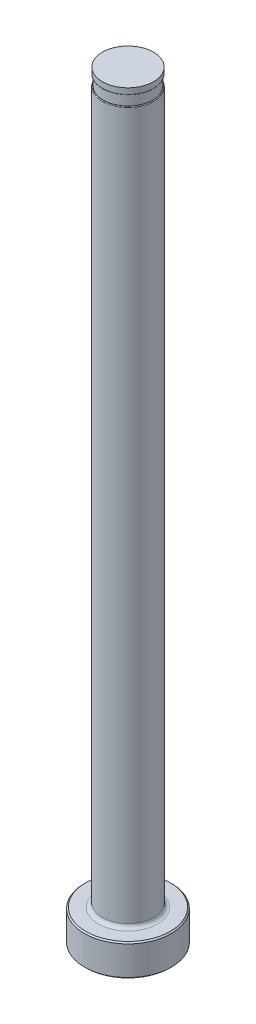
SolidWorks part; units mm, degrees
ref_plane "Front Plane" through (0, 0, 0) normal (0, 0, 1) x (1, 0, 0)
ref_plane "Top Plane" through (0, 0, 0) normal (0, 1, 0) x (1, 0, 0)
ref_plane "Right Plane" through (0, 0, 0) normal (1, 0, 0) x (0, 0, -1)
other "Configuration Table"
sketch "Sketch1" plane through (0, 0, 0) normal (0, 0, 1) x (1, 0, 0)
  line L0 (0, 259.9588) -> (0, -15.1925) construction
  line L1 (0, 0) -> (-8.7249, 0)
  line L2 (-8.7249, 0) -> (-8.7249, 6.35)
  line L3 (-8.7249, 6.35) -> (-5.1587, 6.35)
  line L4 (-5.1587, 6.35) -> (-5.1587, 152.4)
  line L5 (-5.1587, 152.4) -> (0, 152.4)
  line L6 (0, 152.4) -> (0, 0)
  dimension "L" = 152.4
  dimension "H" = 17.4498
  dimension "T" = 6.35
  dimension "D" = 10.3175
revolve "Revolve1" add sketch "Sketch1" angle 360 about L0
chamfer "Chamfer1" distance 0.254 angle 45 2 edges at (0, 6.35, 8.7249) (0, 0, 8.7249)
fillet "Fillet1" radius 0.762 1 edges at (0, 6.35, 5.1587)
sketch "Sketch2" plane through (0, 0, 0) normal (0, 0, 1) x (1, 0, 0)
  line L0 (-5.1587, 152.4) -> (-5.1587, 7.112) construction
  line L1 (-5.1587, 151.13) -> (-4.9555, 151.13)
  line L2 (-5.1587, 151.13) -> (-5.1587, 149.098)
  line L3 (-5.1587, 149.098) -> (-4.9555, 149.098)
  line L4 (-4.9555, 151.13) -> (-4.9555, 149.098)
  line L5 (5.1587, 152.4) -> (-5.1587, 152.4) construction
  line L6 (0, 153.4483) -> (0, 147.3282) construction
  dimension "D1" = 2.032
  dimension "N" = 1.27
  dimension "FD" = 0.2032
  dimension "D3" = 9.9111
revolve "Vent Relief" cut sketch "Sketch2" angle 360 about L6
sketch "Sketch3" plane through (0, 0, 0) normal (0, 0, 1) x (1, 0, 0)
  line L0 (-4.9555, 150.114) -> (-4.9555, 86.614)
  line L1 (-4.9555, 151.13) -> (-4.9555, 149.098) construction
  line L2 (-5.1587, 149.098) -> (-5.1587, 7.112) construction
  line L3 (-5.1587, 85.4964) -> (-5.1587, 150.114)
  line L4 (-5.1587, 150.114) -> (-4.9555, 150.114)
  arc A0 (-4.9555, 86.614) -> (-5.1587, 85.4964) centre (-8.1305, 86.614) cw
  dimension "D1" = 3.175
  dimension "D2" = 63.5
extrude "D-Slot" cut sketch "Sketch3" against normal through all both and the other way through all
sketch "Sketch5" plane through (0, 0, 0) normal (0, 0, 1) x (1, 0, 0)
  line L0 (-5.1587, 151.13) -> (5.1587, 151.13) construction
  line L1 (-5.1587, 152.4) -> (-5.1397, 152.4)
  line L2 (-5.1587, 152.4) -> (-5.1587, 151.13)
  line L3 (-5.1587, 151.13) -> (-5.1397, 151.13)
  line L4 (-5.1397, 152.4) -> (-5.1397, 151.13)
  line L5 (0, 152.6877) -> (0, 150.5771) construction
  dimension "VP" = 0.019
revolve "Vent Diameter" cut sketch "Sketch5" angle 360 about L5
fillet "Fillet2" radius 0.127 2 edges at (5.1587, 149.098, 0) (0, 151.13, 5.1397)
sketch "Pocket Sketch" plane through (0, 0, 0) normal (0, 0, 1) x (1, 0, 0)
  line L0 (-9.1218, 0) -> (-9.1218, 6.3754)
  line L1 (-9.1218, 6.3754) -> (-6.1192, 6.3754)
  line L2 (-5.3572, 7.1374) -> (-5.3572, 22.225)
  line L3 (-5.3572, 22.225) -> (0, 22.225)
  line L4 (0, 22.225) -> (0, 0)
  line L5 (0, 0) -> (-9.1218, 0)
  line L6 (0, 12.6104) -> (0, -2.4989) construction
  line L7 (-8.7249, 6.096) -> (-8.7249, 0.254) construction
  line L8 (8.4709, 6.35) -> (-8.4709, 6.35) construction
  line L9 (-5.1587, 85.4964) -> (-5.1587, 7.112) construction
  line L10 (-6.1192, 6.3754) -> (-5.3572, 7.1374)
  point P3 (-5.3572, 6.3754)
  dimension "D1" = 18.2435
  dimension "D2" = 0.3969
  dimension "D3" = 0.0254
  dimension "D4" = 0.1984
  dimension "D5" = 10.7144
  dimension "D6" = 22.225
